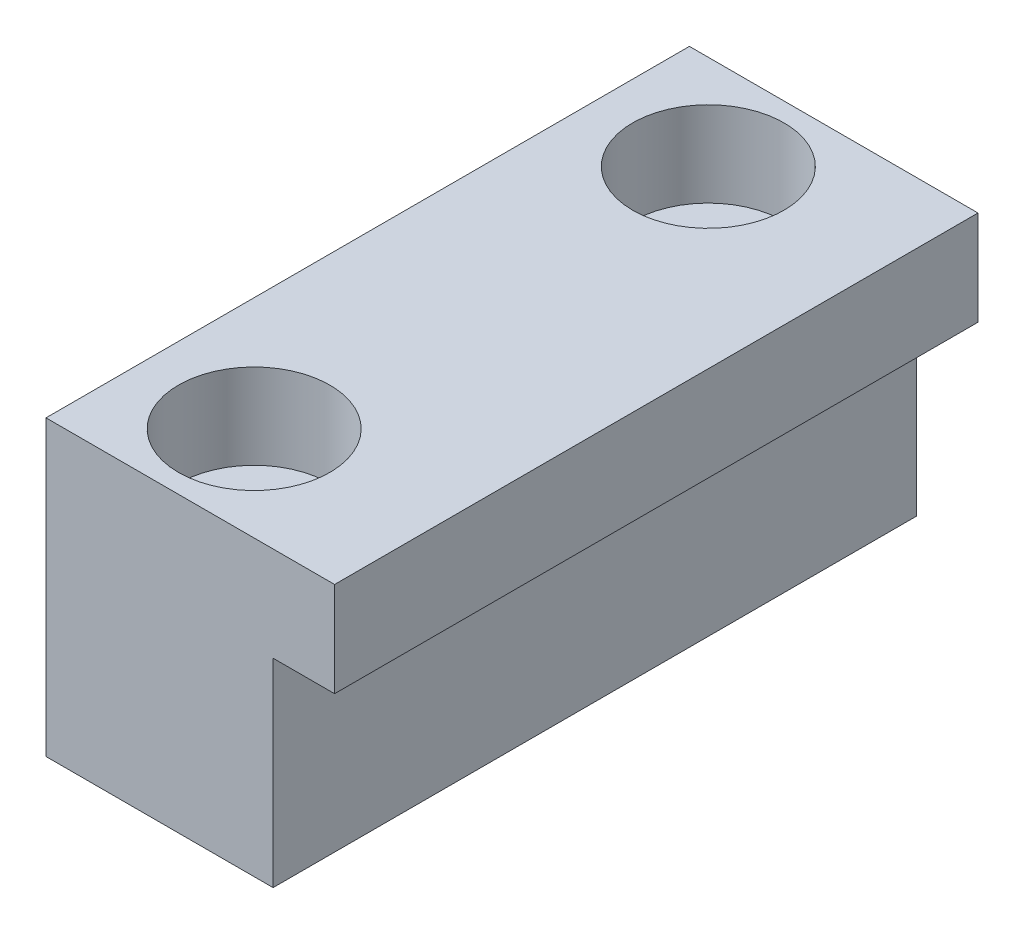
SolidWorks part; units mm, degrees
ref_plane "前视基准面" through (0, 0, 0) normal (0, 0, 1) x (1, 0, 0)
ref_plane "上视基准面" through (0, 0, 0) normal (0, 1, 0) x (1, 0, 0)
ref_plane "右视基准面" through (0, 0, 0) normal (1, 0, 0) x (0, 0, -1)
sketch "草图1" plane through (0, 0, 0) normal (0, 0, 1) x (1, 0, 0)
  line L0 (12, 0) -> (12, 10.5)
  line L1 (0, 0) -> (12, 0)
  line L2 (0, 0) -> (0, 15.5)
  line L3 (0, 15.5) -> (15.25, 15.5)
  line L4 (15.25, 10.5) -> (15.25, 15.5)
  line L5 (12, 10.5) -> (15.25, 10.5)
extrude "凸台-拉伸1" add sketch "草图1" along normal blind 34
sketch "草图2" plane through (0, 15.5, 0) normal (0, 1, 0) x (1, 0, 0)
  circle A0 centre (6, -29) radius 2.25
  circle A1 centre (6, -5) radius 2.25
extrude "切除-拉伸1" cut sketch "草图2" against normal blind 34
sketch "草图3" plane through (0, 15.5, 0) normal (0, 1, 0) x (1, 0, 0)
  circle A0 centre (6, -29) radius 4
  circle A1 centre (6, -5) radius 4
extrude "切除-拉伸2" cut sketch "草图3" against normal blind 4.5
